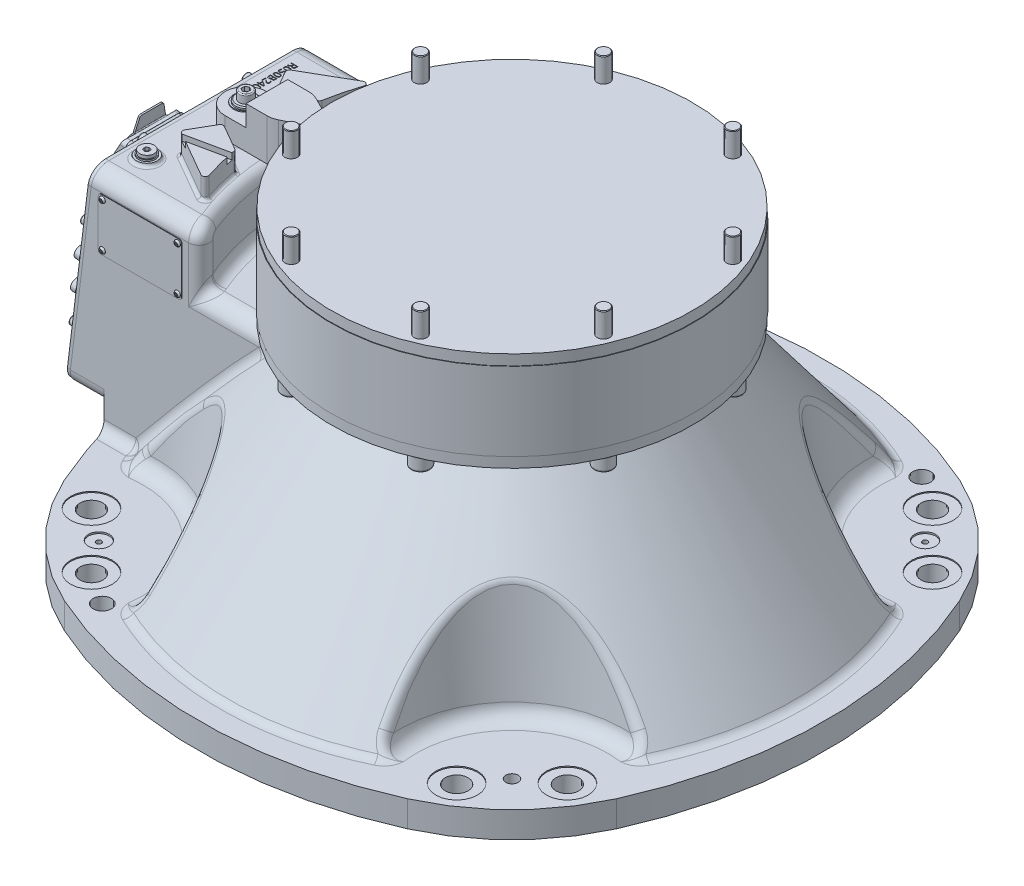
SolidWorks part; units mm, degrees
ref_plane "前视基准面" through (0, 0, 0) normal (0, 0, 1) x (1, 0, 0)
ref_plane "上视基准面" through (0, 0, 0) normal (0, 1, 0) x (1, 0, 0)
ref_plane "右视基准面" through (0, 0, 0) normal (1, 0, 0) x (0, 0, -1)
imported_body "输入1"
imported_body "输入2"
imported_body "输入3"
imported_body "输入4"
imported_body "输入5"
imported_body "输入6"
imported_body "输入7"
imported_body "输入8"
imported_body "输入9"
imported_body "输入10"
imported_body "输入11"
imported_body "输入12"
imported_body "输入13"
imported_body "输入14"
imported_body "输入15"
imported_body "输入16"
imported_body "输入17"
imported_body "输入18"
imported_body "输入19"
imported_body "输入20"
imported_body "输入21"
imported_body "输入22"
imported_body "输入23"
imported_body "输入24"
imported_body "输入25"
imported_body "输入26"
imported_body "输入27"
imported_body "输入28"
imported_body "输入29"
imported_body "输入30"
imported_body "输入31"
imported_body "输入32"
imported_body "输入33"
imported_body "输入34"
imported_body "输入35"
imported_body "输入36"
imported_body "输入37"
imported_body "输入38"
imported_body "输入39"
imported_body "输入40"
imported_body "输入41"
imported_body "输入42"
imported_body "输入43"
imported_body "输入44"
imported_body "输入45"
imported_body "输入46"
imported_body "输入47"
imported_body "输入48"
imported_body "输入49"
imported_body "输入50"
imported_body "输入51"
imported_body "输入52"
imported_body "输入53"
imported_body "输入54"
imported_body "输入55"
imported_body "输入56"
imported_body "输入57"
imported_body "输入58"
imported_body "输入59"
imported_body "输入60"
imported_body "输入61"
imported_body "输入62"
imported_body "输入63"
imported_body "输入64"
imported_body "输入65"
imported_body "输入66"
imported_body "输入67"
imported_body "输入68"
imported_body "输入69"
imported_body "输入70"
imported_body "输入71"
imported_body "输入72"
imported_body "输入73"
imported_body "输入74"
imported_body "输入75"
imported_body "输入76"
imported_body "输入77"
imported_body "输入78"
imported_body "输入79"
imported_body "输入80"
imported_body "输入81"
imported_body "输入82"
imported_body "输入83"
imported_body "输入84"
imported_body "输入85"
imported_body "输入86"
imported_body "输入87"
imported_body "输入88"
imported_body "输入89"
imported_body "输入90"
imported_body "输入91"
imported_body "输入92"
imported_body "输入93"
imported_body "输入94"
imported_body "输入95"
imported_body "输入96"
imported_body "输入97"
imported_body "输入98"
imported_body "输入99"
imported_body "输入100"
imported_body "输入101"
imported_body "输入102"
imported_body "输入103"
imported_body "输入104"
imported_body "输入105"
imported_body "输入106"
imported_body "输入107"
imported_body "输入108"
imported_body "输入109"
imported_body "输入110"
imported_body "输入111"
imported_body "输入112"
imported_body "输入113"
imported_body "输入114"
imported_body "输入115"
imported_body "输入116"
imported_body "曲面-输入1"
imported_body "曲面-输入2"
imported_body "曲面-输入3"
hole_wizard "M20 螺纹孔1" positions "草图2" profile "草图1" tap size "M20" standard "GB"
sketch "草图2" plane through (0, 25, 0) normal (0, 1, 0) x (-1, 0, 0)
  line L0 (0, 0) -> (440.6337, 0) construction
  line L1 (0, 0) -> (143.75, 248.9823) construction
  circle A0 centre (0, 0) radius 287.5 construction
  point P0 (143.75, 248.9823)
  point P16 (-143.75, -248.9823)
  dimension "D1" = 575
  dimension "D2" = 60
  dimension "D3" = 2
sketch "草图1" plane through (-143.75, 25, 248.9823) normal (1, 0, 0) x (0, 0, 1)
  line L0 (0, 0) -> (0, 57.7575)
  line L1 (0, 57.7575) -> (8.75, 52.5)
  line L2 (8.75, 52.5) -> (8.75, 0)
  line L5 (8.75, 0) -> (0, 0)
  line L10 (0, 57.7575) -> (-8.75, 52.5) construction
  line L11 (0, -6.35) -> (0, 107.95) construction
  dimension "螺纹孔钻头直径" = 17.5
  dimension "螺纹孔钻头深度" = 52.5
  dimension "导头角度" = 118
